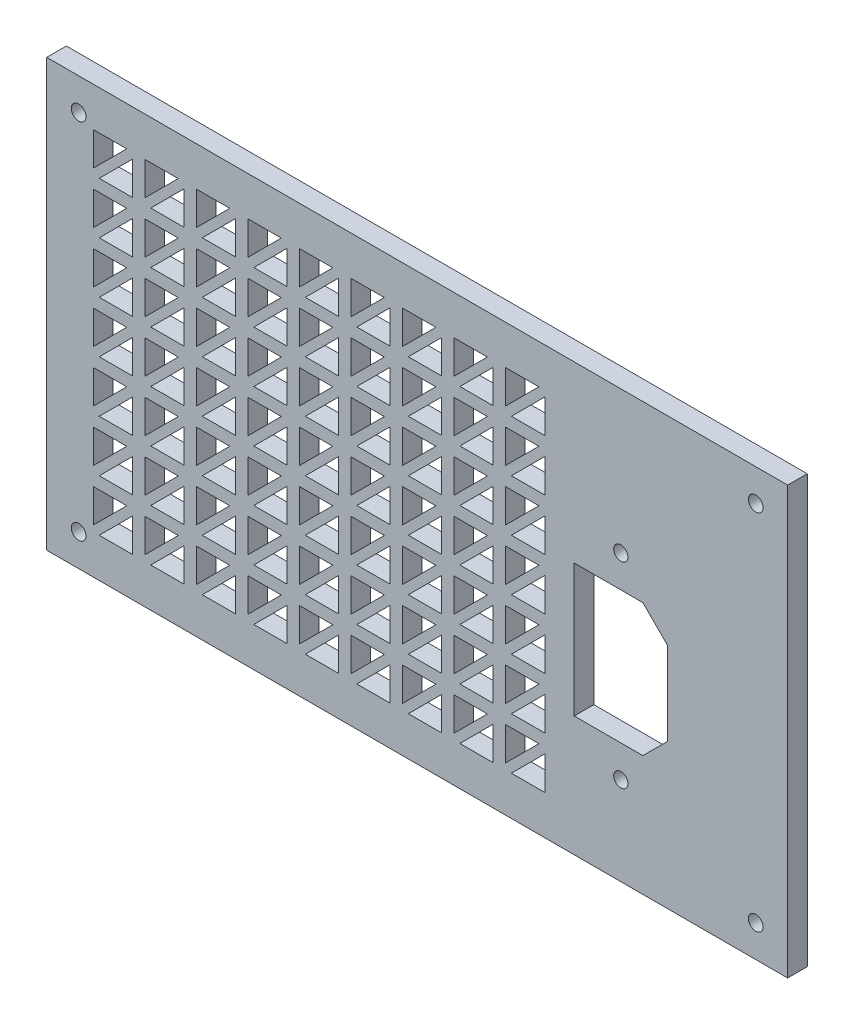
SolidWorks part; units mm, degrees
ref_plane "Top Plane" through (0, 0, 0) normal (0, 0, 1) x (1, 0, 0)
ref_plane "Front Plane" through (0, 0, 0) normal (0, 1, 0) x (1, 0, 0)
ref_plane "Right Plane" through (0, 0, 0) normal (1, 0, 0) x (0, 0, -1)
sketch "Sketch1" plane through (0, 0, 0) normal (0, 0, 1) x (1, 0, 0)
  line L1 (-75.5, 43.5) -> (75.5, 43.5)
  line L2 (-75.5, 43.5) -> (-75.5, -43.5)
  line L3 (-75.5, -43.5) -> (75.5, -43.5)
  line L4 (75.5, 43.5) -> (75.5, -43.5)
  line L5 (-75.5, 43.5) -> (75.5, -43.5) construction
  line L6 (-75.5, -43.5) -> (75.5, 43.5) construction
  point P0 (0, 0)
  dimension "D1" = 151
  dimension "D2" = 87
extrude "Boss-Extrude1" add sketch "Sketch1" along normal mid plane 4
sketch "Sketch3" plane through (0, 0, 2) normal (0, 0, 1) x (1, 0, 0)
  line L1 (-69, 37) -> (69, 37) construction
  line L2 (-69, 37) -> (-69, -37) construction
  line L3 (-69, -37) -> (69, -37) construction
  line L4 (69, 37) -> (69, -37) construction
  line L5 (-69, 37) -> (69, -37) construction
  line L6 (-69, -37) -> (69, 37) construction
  circle A0 centre (-69, 37) radius 1.5
  circle A1 centre (69, 37) radius 1.5
  circle A2 centre (69, -37) radius 1.5
  circle A3 centre (-69, -37) radius 1.5
  point P0 (0, 0)
  dimension "D3" = 3
  dimension "D1" = 138
  dimension "D2" = 74
extrude "Cut-Extrude1" cut sketch "Sketch3" against normal up to next
sketch "Sketch4" plane through (0, 0, 2) normal (0, 0, 1) x (1, 0, 0)
  line L0 (39, -43.5) -> (39, -5.5) construction
  line L1 (-75.5, -43.5) -> (75.5, -43.5) construction
  line L2 (-75.5, 43.5) -> (-75.5, -43.5) construction
  line L3 (32, -19) -> (32, 8)
  line L4 (32, 8) -> (46, 8)
  line L5 (46, 8) -> (51, 3)
  line L6 (51, 3) -> (51, -14)
  line L7 (51, -14) -> (46, -19)
  line L8 (46, -19) -> (32, -19)
  line L9 (32, 8) -> (46, -19) construction
  line L10 (46, 8) -> (32, -19) construction
  line L11 (41.5, 14.5) -> (41.5, -25.5) construction
  line L12 (32, -5.5) -> (51, -5.5) construction
  circle A0 centre (41.5, 14.5) radius 1.45
  circle A1 centre (41.5, -25.5) radius 1.45
  point P8 (39, -5.5)
  point P13 (41.5, -5.5)
  point P17 (42, -1.3645)
  point P19 (51.5, -5.5)
  point P20 (0, 0)
  point P23 (0, 0)
  dimension "D8" = 2.9
  dimension "D1" = 114.5
  dimension "D2" = 38
  dimension "D3" = 27
  dimension "D4" = 45
  dimension "D5" = 45
  dimension "D6" = 14
  dimension "D7" = 19
  dimension "D9" = 40
  dimension "D10" = 9.5
extrude "Cut-Extrude2" cut sketch "Sketch4" against normal up to next
sketch "Sketch6" plane through (0, 0, 2) normal (0, 0, 1) x (1, 0, 0)
  line L0 (75.5, 43.5) -> (-75.5, 43.5) construction
  line L1 (-75.5, 43.5) -> (-75.5, -43.5) construction
  line L7 (-58, 34.3) -> (-64.8, 27.5)
  line L10 (-59.2, 35.5) -> (-66, 28.7)
  line L11 (-66, 35.5) -> (-58, 35.5)
  line L12 (-66, 35.5) -> (-66, 27.5)
  line L13 (-66, 27.5) -> (-58, 27.5)
  line L14 (-58, 35.5) -> (-58, 27.5)
  line L15 (-66, 35.5) -> (-58, 27.5) construction
  line L16 (-66, 27.5) -> (-58, 35.5) construction
  point P1 (-21.5, 0)
  point P3 (-64.8, 27.5)
  point P6 (0, 0)
  point P8 (-66, 32.53)
  point P9 (-58.7606, 35.5)
  point P10 (-67.3778, 27.5)
  point P11 (-66, 28.7)
  point P15 (-56.8561, 35.5)
  point P16 (-56.3821, 33.7739)
  point P17 (-58, 26.4085)
  point P18 (-58, 25.8683)
  point P19 (-62, 31.5)
  point P25 (-61.3163, 29.3632)
  dimension "D2" = 8
  dimension "D3" = 1.2
  dimension "D4" = 8
  dimension "D5" = 8
  dimension "D6" = 1.2
  dimension "D10" = 9.5
extrude "Cut-Extrude4" cut sketch "Sketch6" against normal up to next contours L11 L12 L10 | L14 L7 L13
pattern_linear "LPattern1" count 7 spacing 10.5 along (0, -1, 0) count 9 spacing 10.5 along (1, 0, 0) of "Cut-Extrude4"
sketch "Sketch5" plane through (0, 0, 1.5) normal (0, 0, 1) x (1, 0, 0)
  line L0 (-75.5, 43.5) -> (-75.5, -43.5)
  line L1 (27.1547, 19.1884) -> (56.9499, 19.1884)
  line L2 (27.1547, 19.1884) -> (27.1547, -30.0902)
  line L3 (27.1547, -30.0902) -> (56.9499, -30.0902)
  line L4 (56.9499, 19.1884) -> (56.9499, -30.0902)
  line L5 (27.1547, 19.1884) -> (56.9499, -30.0902) construction
  line L6 (27.1547, -30.0902) -> (56.9499, 19.1884) construction
  line L7 (-75.5, -43.5) -> (75.5, -43.5)
  line L8 (75.5, -43.5) -> (75.5, 43.5)
  line L9 (75.5, 43.5) -> (-75.5, 43.5)
  point P0 (42.0523, -5.4509)
extrude "Cut-Extrude3" cut sketch "Sketch5" against normal blind 3
